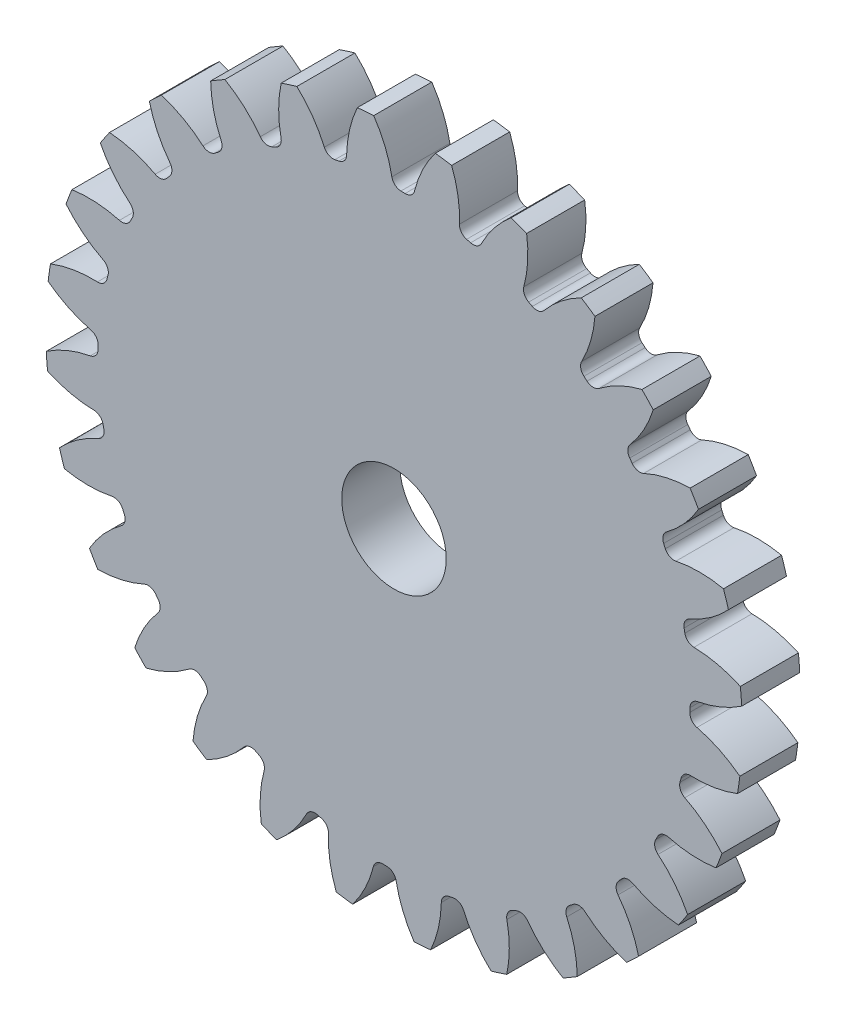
SolidWorks part; units mm, degrees
ref_plane "Front" through (0, 0, 0) normal (0, 0, 1) x (1, 0, 0)
ref_plane "Top" through (0, 0, 0) normal (0, 1, 0) x (1, 0, 0)
ref_plane "Right" through (0, 0, 0) normal (1, 0, 0) x (0, 0, -1)
sketch "Sketch3" plane through (0, 0, 0) normal (0, 0, 1) x (1, 0, 0)
  circle A0 centre (0, 0) radius 762
  dimension "od" = 1524
extrude "gearBody" add sketch "Sketch3" along normal blind 127
sketch "Sketch2" plane through (0, 0, 0) normal (0, 0, 1) x (1, 0, 0)
  line L0 (0, 0) -> (617.4374, 255.7509) construction
  line L1 (757.8412, -91.4149) -> (0, 0) construction
  line L2 (0, 0) -> (36.3143, 0) construction
  line L3 (710.9716, 18.0236) -> (708.5566, -61.2611) construction
  line L5 (709.7641, -21.6188) -> (0, 0) construction
  line L7 (0, 0) -> (668.3094, 0) construction
  arc A0 (668.2876, 5.3968) -> (666.7203, -46.0599) centre (0, 0) ccw construction
  arc A1 (760.7144, 44.2453) -> (756.6113, -90.4616) centre (0, 0) ccw construction
  arc A2 (710.9716, 18.0236) -> (708.5566, -61.2611) centre (0, 0) ccw construction
  arc A3 (647.2464, -24.2362) -> (647.5216, -15.2012) centre (0, 0) ccw
  arc A4 (757.8412, -91.4149) -> (662.8775, -45.0643) centre (600.7273, -292.8551) ccw
  arc A5 (757.8412, -91.4149) -> (762, 45.1219) centre (0, 0) ccw
  arc A6 (762, 45.1219) -> (664.3914, 4.6369) centre (617.4374, 255.7509) cw
  arc A7 (647.5216, -15.2012) -> (664.3914, 4.6369) centre (668.1915, -15.6865) cw
  arc A8 (662.8775, -45.0643) -> (647.2464, -24.2362) centre (667.9075, -25.0099) cw
  point P6 (762, 45.1219)
  point P22 (757.8412, -91.4149)
  dimension "baseDia" = 1336.6188
  dimension "od" = 1524
  dimension "pd" = 1422.4
  dimension "rd" = 1295.4
  dimension "rFillet" = 20.6756
  dimension "pointX" = 762
  dimension "pointY" = 45.1219
  dimension "CTT" = 79.2847
  dimension "flankCenterAngle" = 22.5
extrude "toothCut" cut sketch "Sketch2" along normal through all
pattern_circular "CirPattern1" count 28 over 360 about axis through (0, 0, 0) along (0, 0, 1) of "toothCut"
sketch "hub1Dia" plane through (0, 0, 0) normal (0, 0, -1) x (-1, 0, 0)
  circle A0 centre (0, 0) radius 12.7
  dimension "hub1Dia" = 25.4
sketch "hub2Dia" plane through (0, 0, 127) normal (0, 0, 1) x (1, 0, 0)
  circle A0 centre (0, 0) radius 12.7
  dimension "hub2dia" = 25.4
sketch "boreDia" plane through (0, 0, 0) normal (0, 0, 1) x (1, 0, 0)
  circle A0 centre (0, 0) radius 114.3
  dimension "boreDia" = 228.6
extrude "bore" cut sketch "boreDia" against normal mid plane 25400
